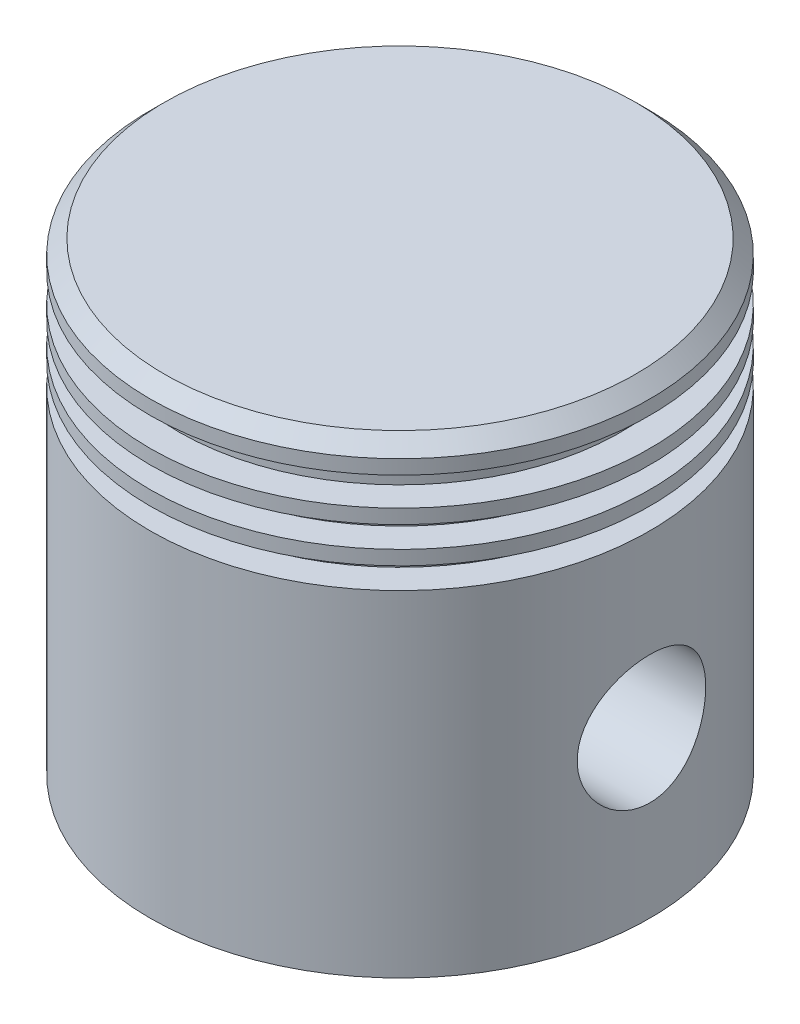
SolidWorks part; units mm, degrees
ref_plane "face" through (0, 0, 0) normal (0, 0, 1) x (1, 0, 0)
ref_plane "dessus" through (0, 0, 0) normal (0, 1, 0) x (1, 0, 0)
ref_plane "profil" through (0, 0, 0) normal (1, 0, 0) x (0, 0, -1)
sketch "Esquisse1" plane through (0, 0, 0) normal (0, 0, 1) x (1, 0, 0)
  line L0 (0, 41.3808) -> (0, -19.7908) construction
  line L1 (0, 21) -> (17.5, 21)
  line L2 (17.5, 21) -> (17.5, 19)
  line L3 (17.5, 19) -> (15.5, 19)
  line L4 (15.5, 19) -> (15.5, 17)
  line L5 (15.5, 17) -> (17.5, 17)
  line L6 (17.5, 17) -> (17.5, 16)
  line L7 (17.5, 16) -> (15.5, 16)
  line L8 (15.5, 16) -> (15.5, 14.5)
  line L9 (15.5, 14.5) -> (17.5, 14.5)
  line L10 (17.5, 14.5) -> (17.5, 13.5)
  line L11 (17.5, 13.5) -> (15.5, 13.5)
  line L12 (15.5, 13.5) -> (15.5, 12)
  line L13 (15.5, 12) -> (17.5, 12)
  line L14 (17.5, 12) -> (17.5, -11.5)
  line L15 (15.5, -11.5) -> (17.5, -11.5)
  line L16 (15.5, -11.5) -> (15.5, 11)
  line L17 (15.5, 11) -> (0, 11)
  line L18 (0, 21) -> (0, 11)
  line L19 (0, 24.8202) -> (0, -13) construction
  dimension "D1" = 17.5
  dimension "D2" = 21
  dimension "D3" = 2
  dimension "D4" = 2
  dimension "D5" = 2
  dimension "D6" = 1
  dimension "D7" = 1.5
  dimension "D8" = 1
  dimension "D9" = 1.5
  dimension "D10" = 11.5
  dimension "D11" = 2
  dimension "D12" = 22.5
revolve "Base-Révolution" add sketch "Esquisse1" angle 360 about L0
chamfer "Chanfrein1" distance 1 angle 45
fillet "Congé1" radius 1.5
ref_plane "Plan1" through (-8, 0, 0) normal (1, 0, 0) x (0, 0, -1)
sketch "Esquisse3" plane through (-8, 0, 0) normal (1, 0, 0) x (0, 0, -1)
  circle A0 centre (0, 0) radius 7
  dimension "D1" = 14
extrude "Boss.-Extru.1" add sketch "Esquisse3" against normal up to next draft 5.5
fillet "Congé2" radius 1.5
mirror "Symétrie1" about plane through (0, 0, 0) normal (1, 0, 0)
sketch "Esquisse4" plane through (-8, 0, 0) normal (1, 0, 0) x (0, 0, -1)
  circle A0 centre (0, 0) radius 4.5
  dimension "D1" = 9
extrude "Enlèv. mat.-Extru.1" cut sketch "Esquisse4" against normal through all and the other way through all
